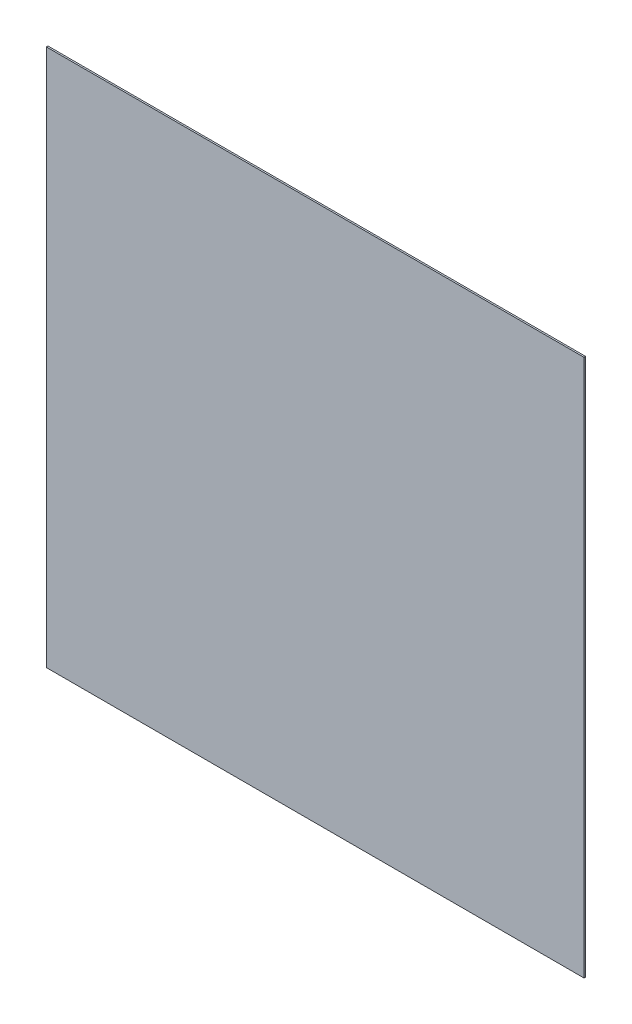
SolidWorks part; units mm, degrees
ref_plane "Plan de face" through (0, 0, 0) normal (0, 0, 1) x (1, 0, 0)
ref_plane "Plan de dessus" through (0, 0, 0) normal (0, 1, 0) x (1, 0, 0)
ref_plane "Plan de droite" through (0, 0, 0) normal (1, 0, 0) x (0, 0, -1)
sketch "Esquisse1" plane through (0, 0, 0) normal (0, 0, 1) x (1, 0, 0)
  line L1 (0, 0) -> (1000, 0)
  line L2 (0, 0) -> (0, 1000)
  line L3 (0, 1000) -> (1000, 1000)
  line L4 (1000, 0) -> (1000, 1000)
  dimension "D1" = 1000
  dimension "D2" = 1000
extrude "Boss.-Extru.1" add sketch "Esquisse1" along normal blind 3
